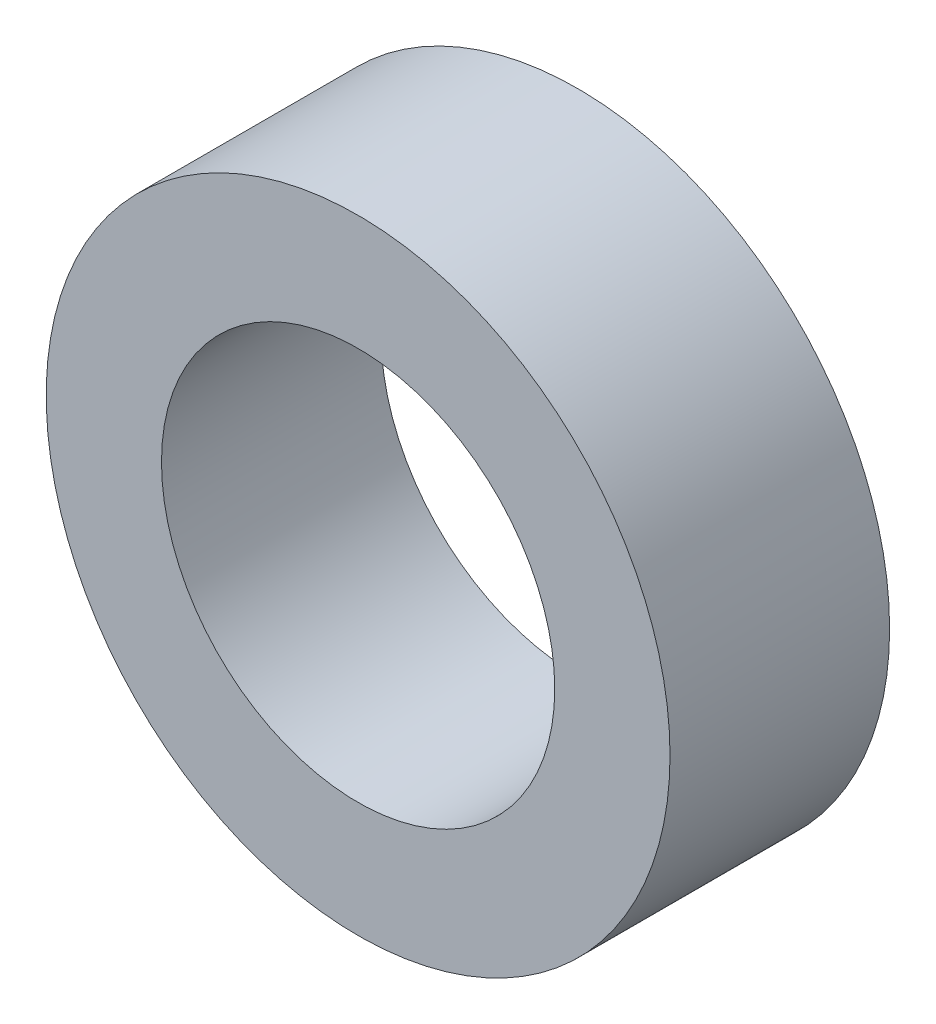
SolidWorks part; units mm, degrees
ref_plane "Front Plane" through (0, 0, 0) normal (0, 0, 1) x (1, 0, 0)
ref_plane "Top Plane" through (0, 0, 0) normal (0, 1, 0) x (1, 0, 0)
ref_plane "Right Plane" through (0, 0, 0) normal (1, 0, 0) x (0, 0, -1)
sketch "Sketch1" plane through (0, 0, 0) normal (0, 0, 1) x (1, 0, 0)
  circle A0 centre (0, 0) radius 5.0038
  circle A1 centre (0, 0) radius 7.9375
  dimension "D1" = 10.0076
  dimension "D2" = 15.875
extrude "Boss-Extrude1" add sketch "Sketch1" along normal blind 5.588
